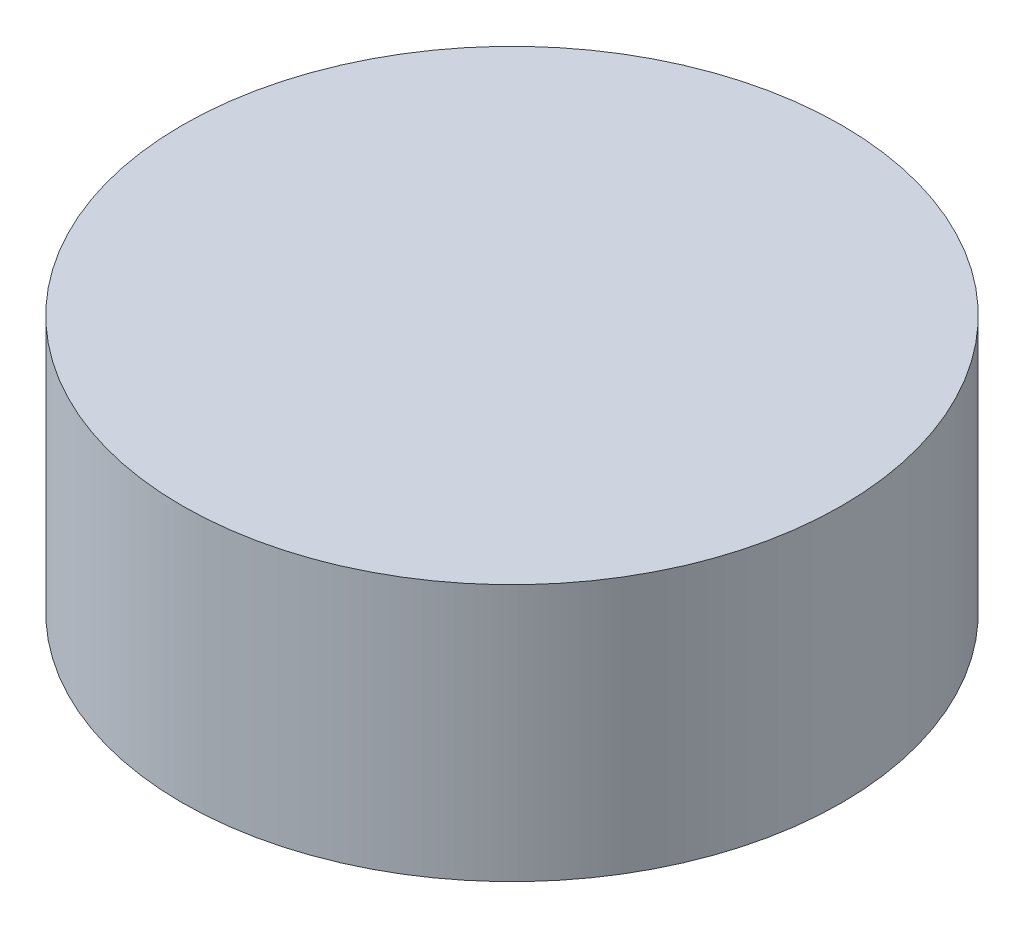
SolidWorks part; units mm, degrees
ref_plane "Front Plane" through (0, 0, 0) normal (0, 0, 1) x (1, 0, 0)
ref_plane "Top Plane" through (0, 0, 0) normal (0, 1, 0) x (1, 0, 0)
ref_plane "Right Plane" through (0, 0, 0) normal (1, 0, 0) x (0, 0, -1)
sketch "Sketch1" plane through (0, 0, 0) normal (0, 1, 0) x (1, 0, 0)
  circle A0 centre (0, 0) radius 19.78
  dimension "D1" = 39.56
extrude "Boss-Extrude1" add sketch "Sketch1" along normal blind 15.43
